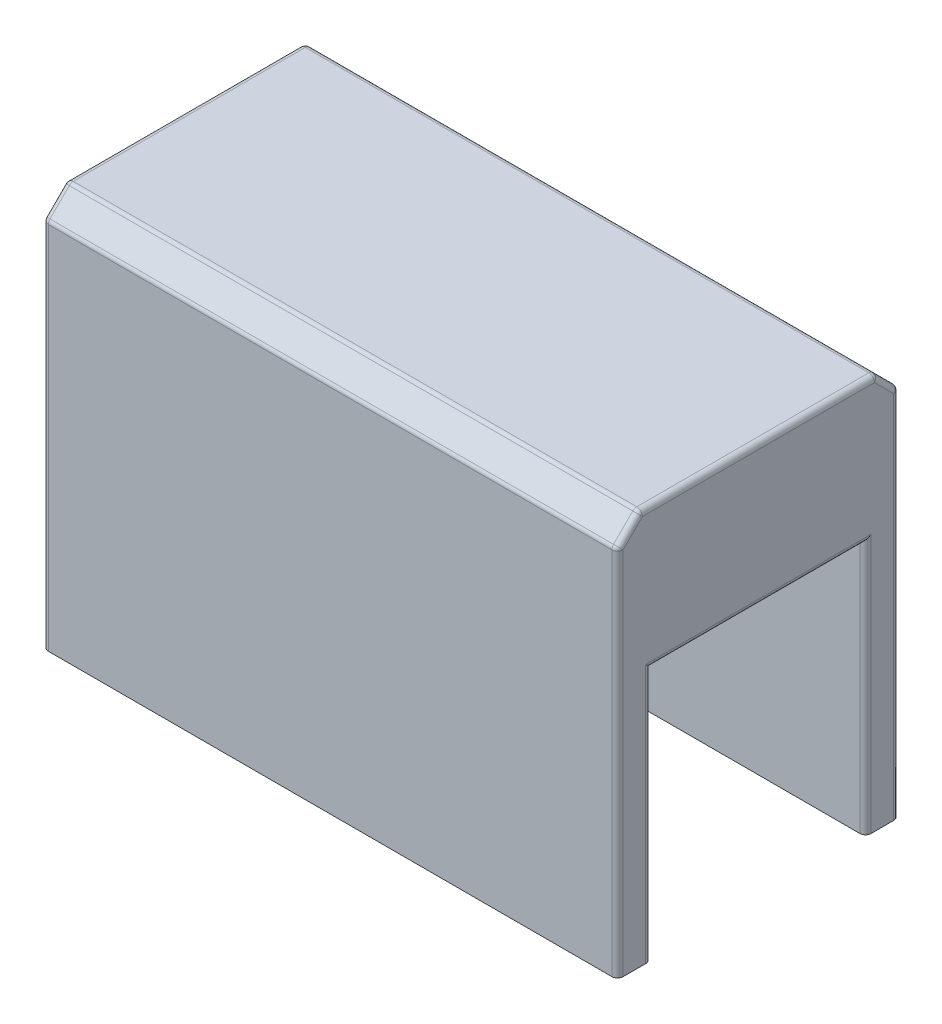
SolidWorks part; units mm, degrees
ref_plane "Alzado" through (0, 0, 0) normal (0, 0, 1) x (1, 0, 0)
ref_plane "Planta" through (0, 0, 0) normal (0, 1, 0) x (1, 0, 0)
ref_plane "Vista lateral" through (0, 0, 0) normal (1, 0, 0) x (0, 0, -1)
sketch "Croquis1" plane through (0, 0, 0) normal (0, 1, 0) x (1, 0, 0)
  line L1 (-510, 250) -> (510, 250)
  line L2 (-510, 250) -> (-510, -250)
  line L3 (-510, -250) -> (510, -250)
  line L4 (510, 250) -> (510, -250)
  line L5 (-510, 250) -> (510, -250) construction
  line L6 (-510, -250) -> (510, 250) construction
  point P0 (0, 0)
  dimension "D1" = 1020
  dimension "D2" = 500
extrude "Saliente-Extruir1" add sketch "Croquis1" along normal blind 700
sketch "Croquis2" plane through (0, 0, 0) normal (1, 0, 0) x (0, 0, -1)
  line L0 (0, 0) -> (0, 450) construction
  line L1 (-250, 0) -> (250, 0) construction
  line L2 (-190, 450) -> (190, 450)
  line L3 (-190, 450) -> (-190, 0)
  line L4 (-190, 0) -> (190, 0)
  line L5 (190, 450) -> (190, 0)
  line L6 (-190, 450) -> (190, 0) construction
  line L7 (-190, 0) -> (190, 450) construction
  point P3 (0, 225)
  dimension "D1" = 380
  dimension "D2" = 450
extrude "Cortar-Extruir1" cut sketch "Croquis2" against normal through all both and the other way through all contours L3 L2 L5 L4
chamfer "Chaflán1" distance 40 angle 45 2 edges at (0, 700, -250) (0, 700, 250)
fillet "Redondeo1" radius 10 10 edges at (510, 330, -250) (510, 225, -190) (510, 450, 0) (510, 225, 190) (510, 330, 250) (-510, 330, 250) (-510, 225, 190) (-510, 225, -190) (-510, 330, -250) (-510, 450, 0)
fillet "Redondeo2" radius 10 6 edges at (510, 685, 225) (507.0711, 662.9289, 247.0711) (-510, 685, 225) (-507.0711, 662.9289, 247.0711) (0, 700, 210) (0, 660, 250)
fillet "Redondeo3" radius 10 10 edges at (503.8268, 699.2388, 209.6847) (-503.8268, 699.2388, 209.6847) (-510, 685, -225) (-507.0711, 662.9289, -247.0711) (510, 685, -225) (507.0711, 662.9289, -247.0711) (510, 700, -7.0711) (-510, 700, -7.0711) (0, 660, -250) (0, 700, -210)
sketch "Croquis3" plane through (0, 0, 0) normal (0, 1, 0) x (1, 0, 0)
  line L1 (450, 190) -> (-450, 190)
  line L2 (450, 190) -> (450, -190)
  line L3 (450, -190) -> (-450, -190)
  line L4 (-450, 190) -> (-450, -190)
  line L5 (450, 190) -> (-450, -190) construction
  line L6 (450, -190) -> (-450, 190) construction
  point P0 (0, 0)
  dimension "D1" = 900
  dimension "D2" = 380
extrude "Cortar-Extruir12" cut sketch "Croquis3" along normal blind 640
